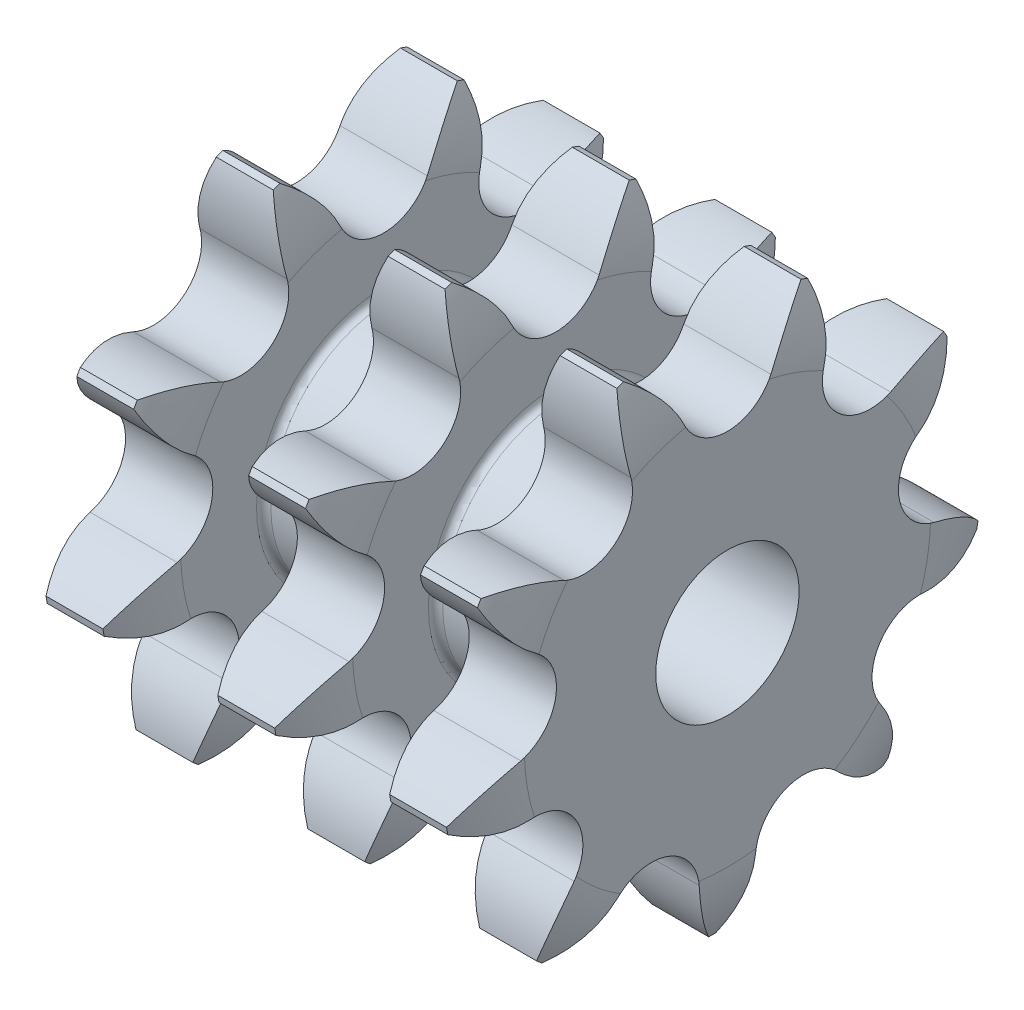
SolidWorks part; units mm, degrees
ref_plane "Plane1" through (0, 0, 0) normal (0, 0, 1) x (1, 0, 0)
ref_plane "Plane2" through (0, 0, 0) normal (0, 1, 0) x (1, 0, 0)
ref_plane "Plane3" through (0, 0, 0) normal (1, 0, 0) x (0, 0, -1)
sketch "Clipboard" plane through (0, 0, 0) normal (0, 1, 0) x (1, 0, 0)
  line L0 (0, 0) -> (12.5436, -1.9867)
  line L1 (-15, 0) -> (100, 0) construction
  line L2 (0, 0) -> (-0.8416, 0.9512)
  line L3 (0, 0) -> (-11.863, 4.5341)
  line L4 (0, 0) -> (3.0618, 0.4849)
  line L5 (0, 0) -> (-2.8109, -1.0484)
  line L6 (0, 0) -> (-29.8924, -20.1685)
  line L7 (-0.8416, 0.9512) -> (36.5829, 8.906)
  line L8 (-76.2, 38.1) -> (-75.2, 38.1)
  line L9 (-73.4321, 41.7084) -> (-72.837, 41.7846)
  line L10 (-73.4741, 12.9512) -> (-59.0941, 12.9512)
  circle A0 centre (0, 0) radius 3.975
  circle A1 centre (0, 0) radius 10.0465
  circle A2 centre (0, 0) radius 25
sketch "BasProSke" plane through (0, 0, 0) normal (0, 1, 0) x (1, 0, 0)
  line L0 (-10, 0) -> (60, 0) construction
  line L1 (0, 0) -> (0, 16.9929)
  line L2 (0, 0) -> (36.06, 0)
  line L3 (36.06, 0) -> (36.06, 16.9929)
  line L4 (34.79, 22.5287) -> (1.27, 22.5287)
  arc A0 (0, 16.9929) -> (1.27, 22.5287) centre (12.7, 16.9929) cw
  arc A1 (36.06, 16.9929) -> (34.79, 22.5287) centre (23.36, 16.9929) ccw
revolve "Base-Revolve" add sketch "BasProSke" angle 360 about L0
sketch "GrvSke" plane through (0, 0, 0) normal (0, 1, 0) x (1, 0, 0)
  line L0 (7.3, 16.9929) -> (7.3, 10.6465)
  line L1 (7.9, 10.0465) -> (13.78, 10.0465)
  line L2 (14.38, 10.6465) -> (14.38, 16.9929)
  line L3 (6.03, 22.5287) -> (15.65, 22.5287)
  line L4 (10.84, 0) -> (10.84, 52.07) construction
  line L5 (-10, 0) -> (60, 0) construction
  line L6 (0, 0) -> (35.56, 0) construction
  arc A0 (14.38, 16.9929) -> (15.65, 22.5287) centre (27.08, 16.9929) cw
  arc A1 (7.3, 16.9929) -> (6.03, 22.5287) centre (-5.4, 16.9929) ccw
  arc A2 (7.3, 10.6465) -> (7.9, 10.0465) centre (7.9, 10.6465) ccw
  arc A3 (13.78, 10.0465) -> (14.38, 10.6465) centre (13.78, 10.6465) ccw
revolve "Groove" cut sketch "GrvSke" angle 360 about L6
pattern_linear "Grooves" count 2 spacing 14.38 along (1, 0, 0) of "Groove"
sketch "TooCutSke" plane through (0, 0, 0) normal (1, 0, 0) x (0, 0, -1)
  line L0 (0, 18.6059) -> (3.6386, 16.9092) construction
  line L1 (0, 0) -> (0, 107) construction
  line L2 (0, 18.6059) -> (-10, 18.6059) construction
  line L3 (0, 18.6059) -> (-3.6386, 16.9092) construction
  arc A0 (3.6386, 16.9092) -> (7.9748, 21.6037) centre (13.1494, 12.4742) cw
  arc A1 (3.6386, 16.9092) -> (-3.6386, 16.9092) centre (0, 18.6059) cw
  arc A2 (-3.6386, 16.9092) -> (-7.9748, 21.6037) centre (-13.1494, 12.4742) ccw
  arc A3 (7.9748, 21.6037) -> (-7.9748, 21.6037) centre (0, 0) ccw
extrude "ToothCut" cut sketch "TooCutSke" along normal through all
pattern_circular "TeethCuts" count 9 every 40 about axis through (-10, 0, 0) along (1, 0, 0) of "ToothCut"
sketch "HubNeaOneSke" plane through (0, 0, 0) normal (-1, 0, 0) x (0, 0, 1)
  circle A0 centre (0, 0) radius 10.0465
extrude "HubNearOne" [suppressed] add sketch "HubNeaOneSke" along normal blind 2.2005
fillet "HubNearOneFillet" [suppressed] radius 0.6
sketch "HubNeaBotSke" plane through (0, 0, 0) normal (-1, 0, 0) x (0, 0, 1)
  circle A0 centre (0, 0) radius 10.0465
extrude "HubNearBoth" [suppressed] add sketch "HubNeaBotSke" along normal blind 1.1003
fillet "HubNearBothFillet" [suppressed] radius 0.6
ref_plane "FarPln" through (36.06, 0, 0) normal (1, 0, 0) x (0, 0, -1)
sketch "HubFarSke" plane through (36.06, 0, 0) normal (1, 0, 0) x (0, 0, -1)
  circle A0 centre (0, 0) radius 10.0465
extrude "HubFar" [suppressed] add sketch "HubFarSke" along normal blind 1.1003
fillet "HubFarFillet" [suppressed] radius 0.6
sketch "BorSke" plane through (0, 0, 0) normal (1, 0, 0) x (0, 0, -1)
  circle A0 centre (0, 0) radius 6
extrude "Bore" cut sketch "BorSke" along normal mid plane 76.521
sketch "KeySke" plane through (0, 0, 0) normal (1, 0, 0) x (0, 0, -1)
  line L0 (-1, 0) -> (-1, 7)
  line L1 (-1, 7) -> (1, 7)
  line L2 (1, 7) -> (1, 0)
  line L3 (0, 0) -> (0, 34) construction
  line L4 (-1, 0) -> (1, 0)
extrude "Keyway" [suppressed] cut sketch "KeySke" along normal mid plane 76.521
pattern_circular "Keyway2" [suppressed] count 2 every 90 about axis through (-10, 0, 0) along (1, 0, 0)
equation "' \"Pitch@Clipboard\" = 12.7"
equation "' \"Num_strands@Clipboard\" = 3"
equation "' \"Num_teeth@Clipboard\" = 9"
equation "' \"Hub_dia@Clipboard\" = 50"
equation "' \"Overall_len@Clipboard\" = 3"
equation "' \"Diameter@BorSke\" = 12"
equation "' \"T_dim@Clipboard\" = 1"
equation "' \"Width@KeySke\" = 2"
equation "' \"Dr@Clipboard\" = 7.95"
equation "' \"Face_width@Clipboard\" = 7.3"
equation "' \"Side_radius@Clipboard\" = 12.7"
equation "' \"Side_relief@Clipboard\" = 1.27"
equation "' \"Transv_pitch@Clipboard\" = 14.38"
equation "' \"Show_teeth@Clipboard\" = 9"
equation "' \"Fillet_rad@Clipboard\" = 0.6"
equation "' \"Plate_wid@Clipboard\" = 12"
equation "\"Num_teeth@Clipboard\" = int( \"Num_teeth@Clipboard\" )"
equation "\"Num_teeth@Clipboard\" = ((sgn( \"Num_teeth@Clipboard\" - 5.0)+1)*( \"Num_teeth@Clipboard\" - 5.0))/2 +5.0"
equation "\"Num_teeth@Clipboard\" = ((sgn( \"Num_teeth@Clipboard\" - 200.0)-1)*( \"Num_teeth@Clipboard\" - 200.0))/-2 +200.0"
equation "\"MHD@Clipboard\" = \"Pitch@Clipboard\" * (1.0 / tan(3.14159265 / \"Num_teeth@Clipboard\" )) - 1.05 * \"Plate_wid@Clipboard\" - 2.0 * \"Fillet_rad@Clipboard\" - 1.0"
equation "\"Thickness@Clipboard\"  = \"Face_width@Clipboard\" + (\"Num_strands@Clipboard\" - 1) * \"Transv_pitch@Clipboard\""
equation "\"OAL@Clipboard\" = \"Thickness@Clipboard\" + 2 * \"Fillet_rad@Clipboard\" + 1"
equation "\"MHD@Clipboard\" = ((sgn( \"MHD@Clipboard\" - \"Hub_dia@Clipboard\" )-1)*( \"MHD@Clipboard\" - \"Hub_dia@Clipboard\" ))/-2+ \"Hub_dia@Clipboard\""
equation "\"OAL@Clipboard\" = ((sgn( \"OAL@Clipboard\" - \"Overall_len@Clipboard\" )+1)*( \"OAL@Clipboard\" - \"Overall_len@Clipboard\" ))/2 + \"Overall_len@Clipboard\" + 0.0005"
equation "\"Num_teeth@TeethCuts\" = int( \"Show_teeth@Clipboard\" ) + 1"
equation "\"Num_teeth@TeethCuts\" = ((sgn( \"Num_teeth@TeethCuts\" - \"Num_teeth@Clipboard\" )-1)*( \"Num_teeth@TeethCuts\" - \"Num_teeth@Clipboard\" ))/-2+ \"Num_teeth@Clipboard\""
equation "\"Num_teeth@TeethCuts\" = ((sgn( \"Num_teeth@TeethCuts\" - 2.0)+1)*( \"Num_teeth@TeethCuts\" - 2.0))/2 +2.0"
equation "\"Angle@TeethCuts\" = 360.0 / \"Num_teeth@Clipboard\""
equation "\"Seat_radius@TooCutSke\" = ( \"Pitch@Clipboard\" / 2.0) / sin(3.14159265 / \"Num_teeth@Clipboard\" ) - \"Dr@Clipboard\" / 2.0 + \"Dr@Clipboard\" * 0.505"
equation "\"R1@TooCutSke\"  = \"Dr@Clipboard\" * 0.505"
equation "\"X@TooCutSke\" = 140.0 - (90.0 / \"Num_teeth@Clipboard\")"
equation "\"R2@TooCutSke\" = 0.12 * \"Dr@Clipboard\" * ( \"Num_teeth@Clipboard\" + 2.0)"
equation "\"Overcut@TooCutSke\" = 0.5 + 0.625 * \"Pitch@Clipboard\" - 0.5 * \"Dr@Clipboard\"  +  \"Pitch@Clipboard\" / 2.0 / sin(3.14159265 / \"Num_teeth@Clipboard\" )"
equation "\"Diameter@BasProSke\" = 2.0 * ( 0.625 * \"Pitch@Clipboard\" - 0.5 * \"Dr@Clipboard\"  +  \"Pitch@Clipboard\" / 2.0 / sin(3.14159265 / \"Num_teeth@Clipboard\" ))"
equation "\"Thickness@BasProSke\"  = \"Thickness@Clipboard\""
equation "\"G1@BasProSke\" =  \"Side_relief@Clipboard\""
equation "\"G2@BasProSke\" =  \"Side_relief@Clipboard\""
equation "\"D1@BasProSke\" =  \"Side_radius@Clipboard\""
equation "\"Diameter@GrvSke\" = \"Diameter@BasProSke\""
equation "\"G1@GrvSke\" = \"Side_relief@Clipboard\""
equation "\"D1@GrvSke\" = \"Side_radius@Clipboard\""
equation "\"Grv_diam@GrvSke\" =  \"Pitch@Clipboard\" * (1.0 / tan(3.14159265 / \"Num_teeth@Clipboard\" ))- 1.05 * \"Plate_wid@Clipboard\" - 2.0 * \"Fillet_rad@Clipboard\" - 1.0"
equation "\"Grv_width@GrvSke\" =  \"Transv_pitch@Clipboard\" - \"Face_width@Clipboard\""
equation "\"Offset@GrvSke\" = \"Grv_width@GrvSke\" / 2.0 + \"Face_width@Clipboard\""
equation "\"Fillet_rad@GrvSke\" = \"Fillet_rad@Clipboard\""
equation "\"Offset@Grooves\" = \"Transv_pitch@Clipboard\""
equation "\"Num_grvs@Grooves\" = \"Num_strands@Clipboard\""
equation "\"Num_grvs@Grooves\" = \"Num_grvs@Grooves\" - 1 * sgn( \"Num_grvs@Grooves\" -1)"
equation "\"Diameter@HubNeaOneSke\" = \"MHD@Clipboard\""
equation "\"Length@HubNearOne\" = \"OAL@Clipboard\" - \"Thickness@BasProSke\""
equation "\"Diameter@HubNeaBotSke\" = \"MHD@Clipboard\""
equation "\"Length@HubNearBoth\" = ( \"OAL@Clipboard\" - \"Thickness@BasProSke\" ) / 2.0"
equation "\"D1@HubNearOneFillet\" = \"Fillet_rad@Clipboard\""
equation "\"D1@HubNearBothFillet\" = \"Fillet_rad@Clipboard\""
equation "\"Thickness@FarPln\" = \"Thickness@BasProSke\""
equation "\"Diameter@HubFarSke\" = \"MHD@Clipboard\""
equation "\"Length@HubFar\" = ( \"OAL@Clipboard\" - \"Thickness@BasProSke\" ) / 2.0"
equation "\"D1@HubFarFillet\" = \"Fillet_rad@Clipboard\""
equation "\"D1@Bore\" = \"OAL@Clipboard\" * 2.0"
equation "\"D1@Keyway\" = \"OAL@Clipboard\" * 2.0"
equation "\"Offset@KeySke\" = \"T_dim@Clipboard\" + \"Diameter@BorSke\" / 2.0"
